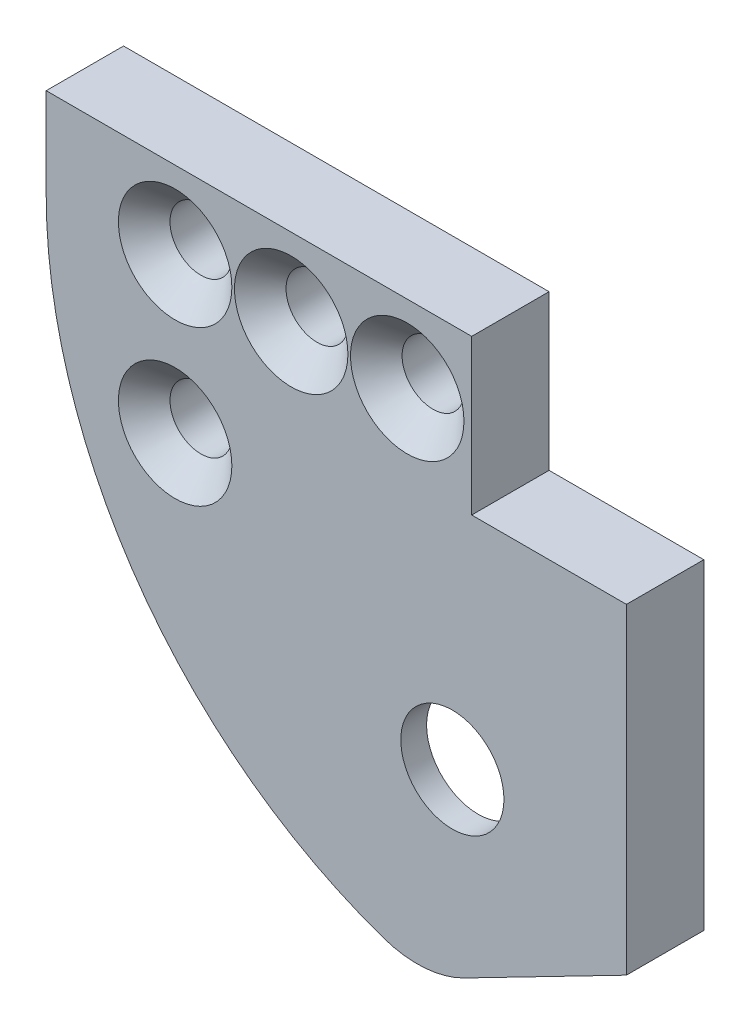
SolidWorks part; units mm, degrees
ref_plane "Plan de face" through (0, 0, 0) normal (0, 0, 1) x (1, 0, 0)
ref_plane "Plan de dessus" through (0, 0, 0) normal (0, 1, 0) x (1, 0, 0)
ref_plane "Plan de droite" through (0, 0, 0) normal (1, 0, 0) x (0, 0, -1)
sketch "Esquisse1" plane through (0, 0, 11) normal (0, 0, 1) x (1, 0, 0)
  line L0 (32, 71) -> (32, 65)
  line L1 (32, 65) -> (38, 65)
  line L2 (38, 65) -> (38, 52.5478)
  line L3 (38, 52.5478) -> (30.2922, 48.5768)
  line L4 (15.5, 67.5) -> (15.5, 71)
  line L5 (15.5, 71) -> (32, 71)
  line L10 (38, 61.5) -> (38, 71) construction
  line L11 (38, 71) -> (23, 71) construction
  arc A0 (15.5, 67.5) -> (30.2922, 48.5768) centre (35, 67.5) ccw
  dimension "D1" = 6
  dimension "D3" = 19.5
  dimension "D2" = 6
  dimension "D4" = 3
  dimension "D5" = 2.5
  dimension "D6" = 12.4522
  dimension "D7" = 7.7078
extrude "Boss.-Extru.1" add sketch "Esquisse1" along normal blind 3
hole_wizard "Fraisage pour vis à tête fraisée M21" positions "Esquisse3" profile "Esquisse2" countersink size "M2" standard "Iso"
sketch "Esquisse3" plane through (0, 0, 14) normal (0, 0, 1) x (1, 0, 0)
  line L0 (32, 65) -> (32, 71) construction
  line L3 (32, 71) -> (15.5, 71) construction
  point P0 (20.5, 68)
  dimension "D1" = 11.5
  dimension "D2" = 3
sketch "Esquisse2" plane through (20.5, 68, 14) normal (1, 0, 0) x (0, -1, 0)
  line L0 (0, 0) -> (0, 3)
  line L1 (0, 3) -> (1.2, 3)
  line L2 (1.2, 3) -> (1.2, 1)
  line L3 (1.2, 1) -> (2.2, 0)
  line L5 (2.2, 0) -> (0, 0)
  line L6 (-1.2, 1) -> (-2.2, 0) construction
  line L11 (0, -6.35) -> (0, 107.95) construction
  dimension "Diamètre du perçage jusqu'au prochain" = 2.4
  dimension "Profondeur du perçage jusqu'au prochain" = 3
  dimension "Diamètre du fraisage entrant" = 4.4
  dimension "Angle du fraisage entrant" = 90
pattern_linear "Répétition linéaire1" count 3 spacing 4.5 along (1, 0, 0) of "Fraisage pour vis à tête fraisée M21"
pattern_linear "Répétition linéaire2" count 2 spacing 6 along (0, -1, 0) of "Fraisage pour vis à tête fraisée M21"
sketch "Esquisse4" plane through (0, 0, 14) normal (0, 0, 1) x (1, 0, 0)
  circle A0 centre (31.25, 56.0758) radius 2
  circle A1 centre (31.25, 56.0758) radius 2 construction
extrude "Enlèv. mat.-Extru.1" cut sketch "Esquisse4" against normal up to next
sketch "Esquisse5" plane through (0, 0, 11) normal (0, 0, -1) x (-1, 0, 0)
  circle A0 centre (-31.25, 56.0758) radius 5.5
  circle A1 centre (-31.25, 56.0758) radius 2 construction
  dimension "D1" = 11
extrude "Enlèv. mat.-Extru.2" cut sketch "Esquisse5" against normal blind 2
fillet "Congé1" radius 4 1 edges at (30.2922, 48.5768, 12.5)
